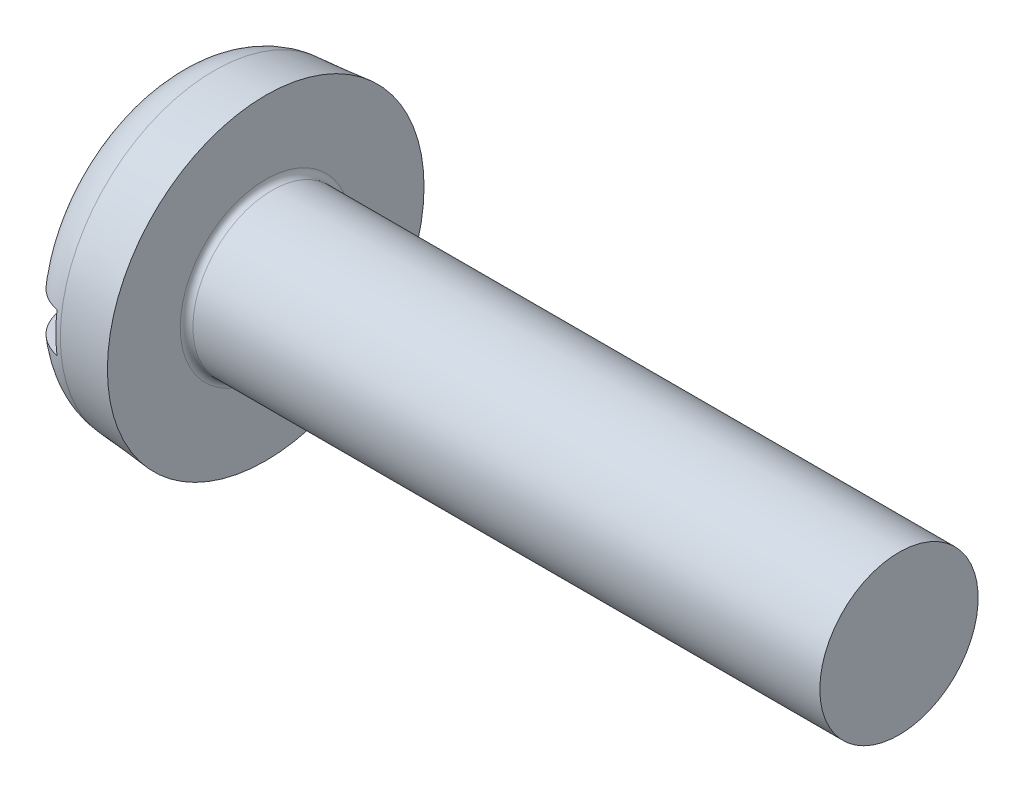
SolidWorks part; units mm, degrees
ref_plane "Front Plane" through (0, 0, 0) normal (0, 0, 1) x (1, 0, 0)
ref_plane "Top Plane" through (0, 0, 0) normal (0, 1, 0) x (1, 0, 0)
ref_plane "Right Plane" through (0, 0, 0) normal (1, 0, 0) x (0, 0, -1)
sketch "BodySke" plane through (0, 0, 0) normal (0, 0, 1) x (1, 0, 0)
  line L0 (0, 0) -> (111.3824, 0) construction
  line L1 (0, 0) -> (0, 9.4751)
  line L2 (0, 9.4751) -> (6, 10)
  line L3 (6, 10) -> (6, 5)
  line L4 (6, 5) -> (46, 5)
  line L5 (46, 5) -> (46, 0)
  line L6 (7.5, 8.824) -> (7.5, -5.8939) construction
  line L7 (0, 0) -> (46, 0)
  line L8 (8, 8.824) -> (8, -4.958) construction
  point P10 (46, 4.172)
  dimension "Diameter" = 10
  dimension "Head_dia" = 20
  dimension "Head_height" = 6
  dimension "Head_side_angle" = 5
  dimension "Length" = 40
  dimension "Advance" = 1.5
  dimension "Thread_minor" = 8.344
  dimension "Thread_length" = 38
revolve "BaseBody" add sketch "BodySke" angle 360 about L0
fillet "Fillet_head" radius 3 1 edges at (0, 0, 9.4751)
fillet "Fillet2" radius 0.4 1 edges at (6, 0, 5)
sketch "SlotSke" plane through (0, 0, 0) normal (-1, 0, 0) x (0, 0, 1)
  line L1 (-10, 1.25) -> (10, 1.25)
  line L2 (-10, 1.25) -> (-10, -1.25)
  line L3 (-10, -1.25) -> (10, -1.25)
  line L4 (10, 1.25) -> (10, -1.25)
  dimension "D1" = 20
  dimension "D2" = 10
  dimension "D3" = 1.25
  dimension "Slot_width" = 2.5
extrude "Slot" cut sketch "SlotSke" against normal blind 2.4
sketch "ThdSchSke" plane through (0, 0, 0) normal (0, 0, 1) x (1, 0, 0)
  line L0 (0, 0) -> (55.1256, 0) construction
  line L1 (0, 0) -> (111.3824, 0) construction
  line L2 (45.522, 5) -> (45.522, 5.9561)
  line L3 (45.522, 5.9561) -> (46.478, 5.9561)
  line L4 (46.478, 5.9561) -> (46.478, 5)
  line L5 (46.478, 5) -> (46, 4.172)
  line L6 (46, 4.172) -> (45.522, 5)
  line L7 (6, 5) -> (46, 5) construction
  line L13 (46, 5) -> (46, 0) construction
revolve "ThreadSchematic" [suppressed] cut sketch "ThdSchSke" angle 360 about L0
pattern_linear "ThdSchPat" [suppressed] count 25 along (1, 0, 0)
equation "\"Thread_minor@ThreadCosmetic\" = \"Thread_minor@BodySke\""
equation "\"D1@SlotSke\" = \"Head_dia@BodySke\""
equation "\"D2@SlotSke\" = \"D1@SlotSke\" / 2"
equation "\"D3@SlotSke\" = \"Slot_width@SlotSke\" / 2"
equation "\"Advance@ThdSchPat\" = \"Advance@BodySke\""
equation "\"D1@ThdSchPat\" =  int( \"Thread_length@BodySke\" /\"Advance@ThdSchPat\" ) "
